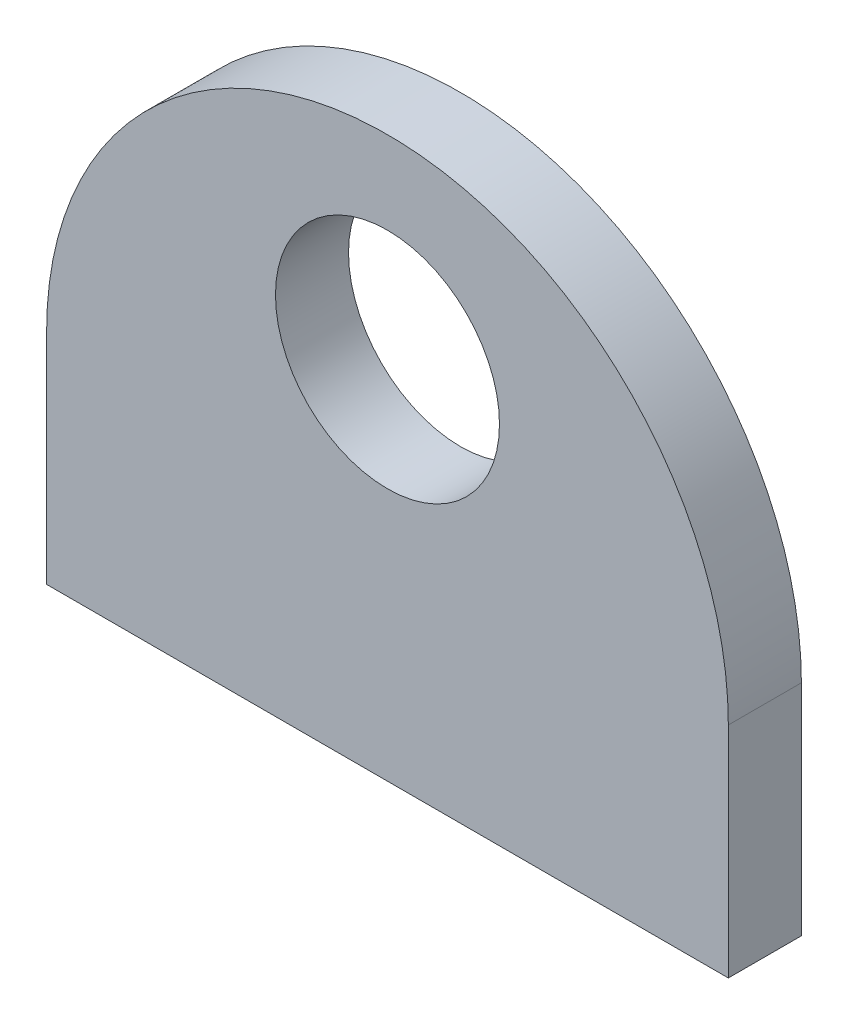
SolidWorks part; units mm, degrees
ref_plane "Plan1" through (0, 0, 0) normal (0, 0, 1) x (1, 0, 0)
ref_plane "Plan2" through (0, 0, 0) normal (0, 1, 0) x (1, 0, 0)
ref_plane "Plan3" through (0, 0, 0) normal (1, 0, 0) x (0, 0, -1)
sketch "Esquisse1" plane through (0, 0, 0) normal (0, 0, 1) x (1, 0, 0)
  line L1 (14, -6) -> (14, -15)
  line L2 (-14, -15) -> (14, -15)
  line L3 (-14, -15) -> (-14, -6)
  arc A0 (14, -6) -> (-14, -6) centre (0, -6) ccw
  circle A2 centre (0, 0) radius 4.6
  dimension "D1" = 14
  dimension "D4" = 9.2
  dimension "D2" = 9
  dimension "D5" = 15
  dimension "D6" = 28
  dimension "D7" = 14
extrude "Base-Extrusion" add sketch "Esquisse1" along normal blind 3
